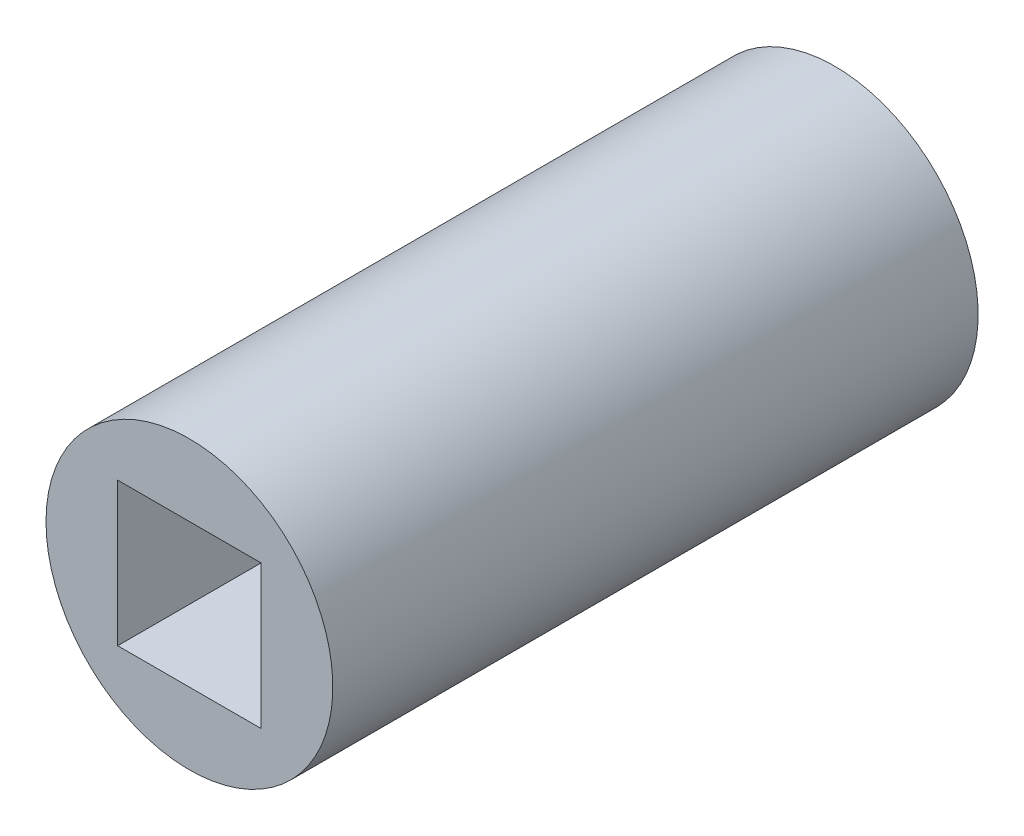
SolidWorks part; units mm, degrees
ref_plane "Front Plane" through (0, 0, 0) normal (0, 0, 1) x (1, 0, 0)
ref_plane "Top Plane" through (0, 0, 0) normal (0, 1, 0) x (1, 0, 0)
ref_plane "Right Plane" through (0, 0, 0) normal (1, 0, 0) x (0, 0, -1)
sketch "Sketch1" plane through (0, 0, 0) normal (0, 0, 1) x (1, 0, 0)
  line L1 (-5, 5) -> (5, 5)
  line L2 (-5, 5) -> (-5, -5)
  line L3 (-5, -5) -> (5, -5)
  line L4 (5, 5) -> (5, -5)
  circle A0 centre (0, 0) radius 10
  dimension "D1" = 20
  dimension "D2" = 10
  dimension "D3" = 10
  dimension "D4" = 5
  dimension "D5" = 5
extrude "Boss-Extrude1" add sketch "Sketch1" along normal blind 45
